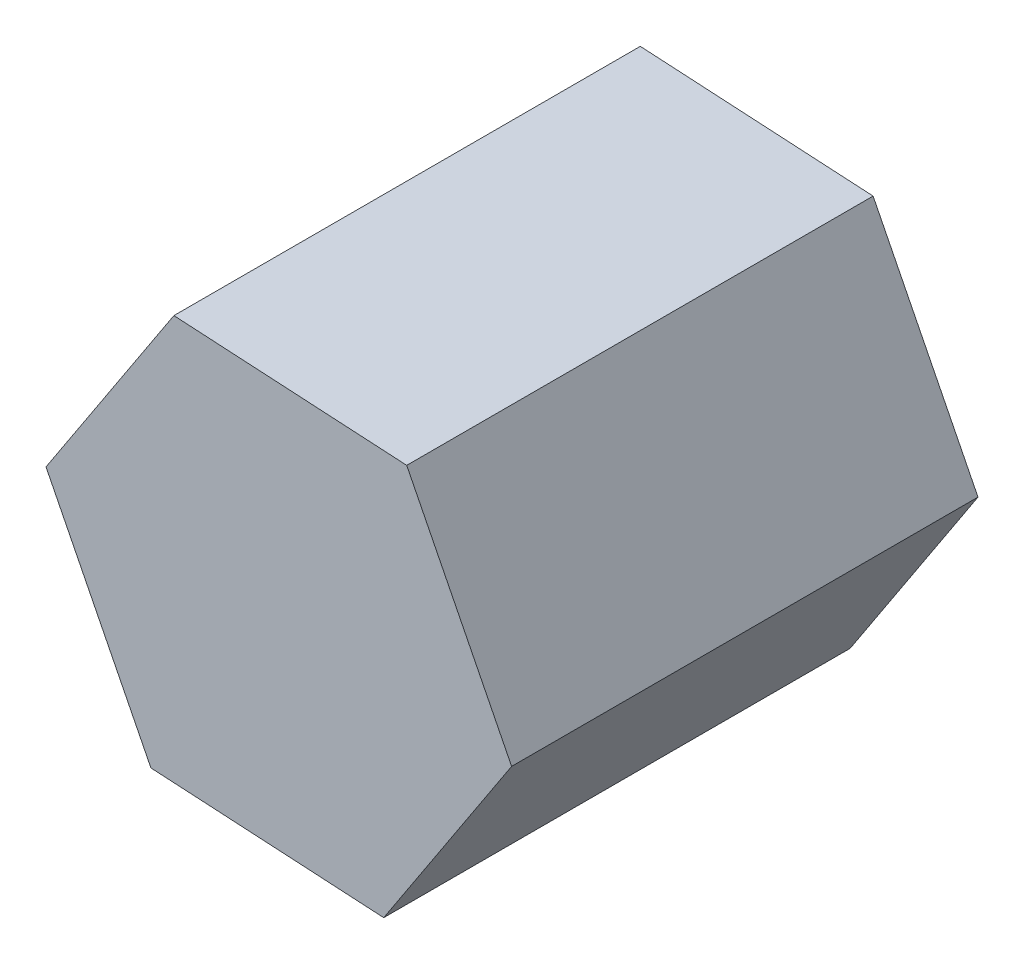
SolidWorks part; units mm, degrees
ref_plane "前视基准面" through (0, 0, 0) normal (0, 0, 1) x (1, 0, 0)
ref_plane "上视基准面" through (0, 0, 0) normal (0, 1, 0) x (1, 0, 0)
ref_plane "右视基准面" through (0, 0, 0) normal (1, 0, 0) x (0, 0, -1)
other "Configuration Table"
sketch "草图1" plane through (0, 0, 0) normal (0, 0, 1) x (1, 0, 0)
  line L1 (29.9513, -1.7091) -> (16.4558, 25.084)
  line L2 (16.4558, 25.084) -> (-13.4955, 26.7931)
  line L3 (-13.4955, 26.7931) -> (-29.9513, 1.7091)
  line L4 (-29.9513, 1.7091) -> (-16.4558, -25.084)
  line L5 (-16.4558, -25.084) -> (13.4955, -26.7931)
  line L6 (13.4955, -26.7931) -> (29.9513, -1.7091)
  circle A0 centre (0, 0) radius 30 construction
extrude "凸台-拉伸1" add sketch "草图1" along normal blind 60 contours L1 L2 L3 L4 L5 L6
